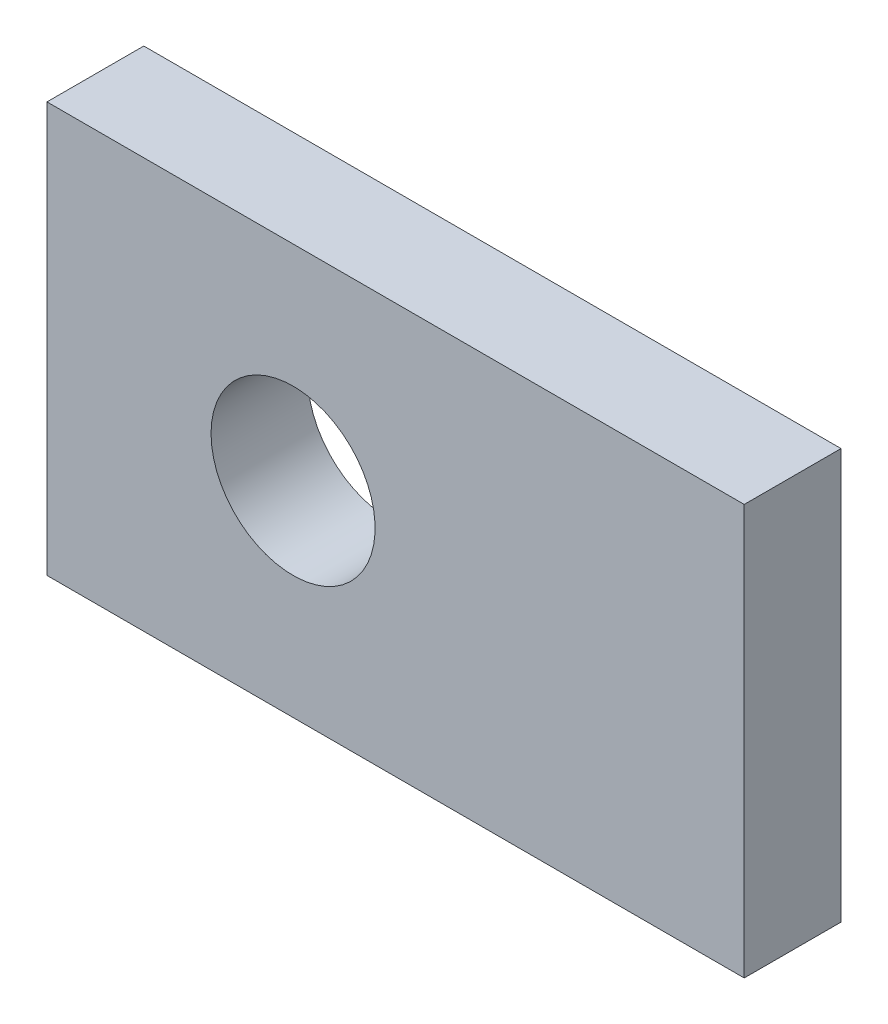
SolidWorks part; units mm, degrees
ref_plane "Front Plane" through (0, 0, 0) normal (0, 0, 1) x (1, 0, 0)
ref_plane "Top Plane" through (0, 0, 0) normal (0, 1, 0) x (1, 0, 0)
ref_plane "Right Plane" through (0, 0, 0) normal (1, 0, 0) x (0, 0, -1)
sketch "Sketch1" plane through (0, 0, 0) normal (0, 0, 1) x (1, 0, 0)
  line L1 (0, 0) -> (21.59, 0)
  line L2 (0, 0) -> (0, 12.7)
  line L3 (0, 12.7) -> (21.59, 12.7)
  line L4 (21.59, 0) -> (21.59, 12.7)
  circle A0 centre (7.62, 6.35) radius 2.54
  dimension "D4" = 5.08
  dimension "D1" = 12.7
  dimension "D2" = 21.59
  dimension "D3" = 7.62
extrude "Boss-Extrude1" add sketch "Sketch1" along normal blind 2.9972
